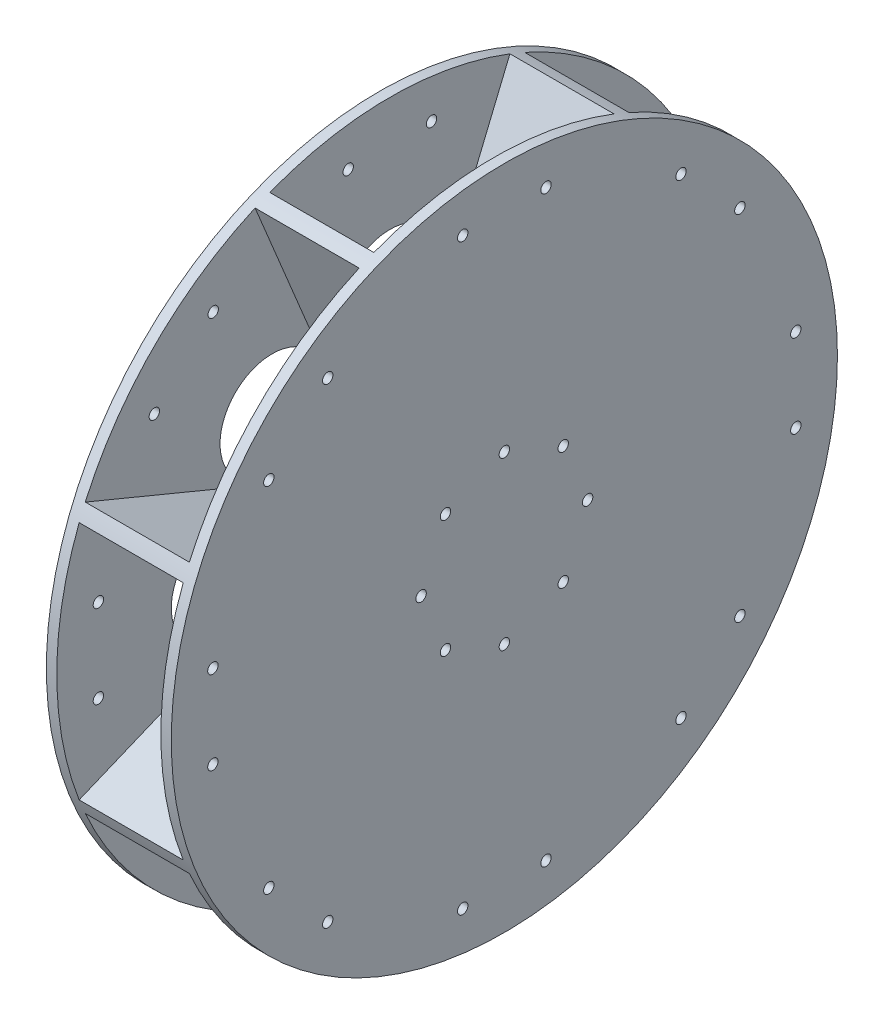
SolidWorks part; units mm, degrees
ref_plane "Front Plane" through (0, 0, 0) normal (0, 0, 1) x (1, 0, 0)
ref_plane "Top Plane" through (0, 0, 0) normal (0, 1, 0) x (1, 0, 0)
ref_plane "Right Plane" through (0, 0, 0) normal (1, 0, 0) x (0, 0, -1)
sketch "Sketch1" plane through (0, 0, 0) normal (1, 0, 0) x (0, 0, -1)
  circle A0 centre (0, 0) radius 203.2
  dimension "D1" = 406.4
extrude "Boss-Extrude1" add sketch "Sketch1" along normal blind 76.2
sketch "Sketch6" plane through (76.2, 0, 0) normal (1, 0, 0) x (0, 0, -1)
  line L0 (0, 0) -> (0, 177.8) construction
  circle A0 centre (0, 101.6) radius 31.75
  circle A1 centre (25.4, 177.8) radius 3.175
  circle A2 centre (-25.4, 177.8) radius 3.175
  circle A3 centre (0, 50.8) radius 3.175
  dimension "D1" = 63.5
  dimension "D2" = 6.35
  dimension "D6" = 6.35
  dimension "D3" = 101.6
  dimension "D4" = 76.2
  dimension "D5" = 25.4
  dimension "D7" = 50.8
extrude "Cut-Extrude1" cut sketch "Sketch6" against normal through all
pattern_circular "CirPattern1" count 8 every 45 about axis through (0, 0, 0) along (1, 0, 0) of "Cut-Extrude1"
ref_plane "Plane1" through (38.1, 0, 0) normal (1, 0, 0) x (0, 0, -1)
sketch "Sketch8" plane through (38.1, 0, 0) normal (1, 0, 0) x (0, 0, -1)
  line L0 (0, 0) -> (203.2, 0) construction
  line L1 (12.7, 0) -> (189.5385, -73.2489)
  line L10 (12.7, 0) -> (189.5385, 73.2489)
  circle A4 centre (0, 0) radius 203.2 construction
  arc A5 (189.5385, -73.2489) -> (189.5385, 73.2489) centre (0, 0) ccw
  point P0 (0, 0)
  dimension "D1" = 0
  dimension "D2" = 12.7
  dimension "D3" = 22.5
  dimension "D4" = 22.5
extrude "Cut-Extrude3" cut sketch "Sketch8" along normal mid plane 63.5
pattern_circular "CirPattern2" count 8 over 360 about axis through (0, 0, 0) along (1, 0, 0) of "Cut-Extrude3"
sketch "Sketch11" plane through (76.2, 0, 0) normal (1, 0, 0) x (0, 0, -1)
  circle A0 centre (0, 101.6) radius 31.75 construction
  circle A1 centre (0, 101.6) radius 31.75
extrude "Boss-Extrude2" add sketch "Sketch11" against normal blind 6.35
pattern_circular "CirPattern4" count 8 every 45 about axis through (76.2, 0, 0) along (1, 0, 0) of "Boss-Extrude2"
